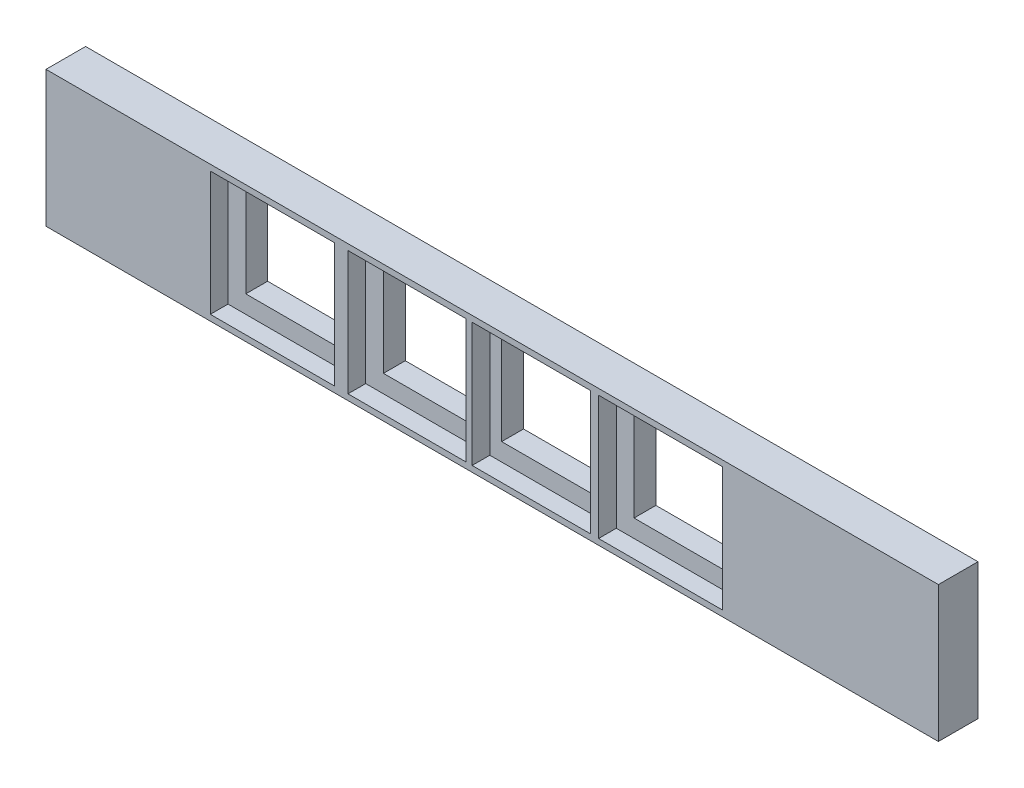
SolidWorks part; units mm, degrees
ref_plane "Front Plane" through (0, 0, 0) normal (0, 0, 1) x (1, 0, 0)
ref_plane "Top Plane" through (0, 0, 0) normal (0, 1, 0) x (1, 0, 0)
ref_plane "Right Plane" through (0, 0, 0) normal (1, 0, 0) x (0, 0, -1)
sketch "Sketch1" plane through (0, 0, 0) normal (0, 0, 1) x (1, 0, 0)
  line L0 (151, 11.5) -> (119, 11.5) construction
  line L1 (0, 0) -> (151, 0)
  line L2 (0, 0) -> (0, 23)
  line L3 (0, 23) -> (151, 23)
  line L4 (151, 0) -> (151, 23)
  line L5 (0, 11.5) -> (19, 11.5) construction
  dimension "D1" = 151
  dimension "D2" = 23
  dimension "D3" = 32
  dimension "D4" = 19
extrude "Boss-Extrude1" add sketch "Sketch1" along normal blind 6.7 contours L2 L3 L4 L1
sketch "Sketch2" plane through (0, 0, 6.7) normal (0, 0, 1) x (1, 0, 0)
  line L0 (151, 11.5) -> (104, 11.5) construction
  line L1 (151, 0) -> (151, 23) construction
  line L2 (111.5, 19) -> (96.5, 4) construction
  line L3 (96.5, 19) -> (111.5, 19)
  line L4 (96.5, 19) -> (96.5, 4)
  line L5 (96.5, 4) -> (111.5, 4)
  line L6 (111.5, 19) -> (111.5, 4)
  line L7 (96.5, 11.5) -> (89.1, 11.5) construction
  line L8 (74.1, 11.5) -> (69.1, 11.5) construction
  line L9 (74.1, 19) -> (89.1, 19)
  line L10 (74.1, 19) -> (74.1, 4)
  line L11 (74.1, 4) -> (89.1, 4)
  line L12 (89.1, 19) -> (89.1, 4)
  line L13 (54.1, 11.5) -> (45.8, 11.5) construction
  line L14 (69.1, 19) -> (54.1, 19)
  line L15 (69.1, 19) -> (69.1, 4)
  line L16 (69.1, 4) -> (54.1, 4)
  line L17 (54.1, 19) -> (54.1, 4)
  line L19 (45.8, 19) -> (30.8, 19)
  line L20 (45.8, 19) -> (45.8, 4)
  line L21 (45.8, 4) -> (30.8, 4)
  line L22 (30.8, 19) -> (30.8, 4)
  point P8 (104, 11.5)
  dimension "D1" = 47
  dimension "D2" = 15
  dimension "D3" = 15
  dimension "D4" = 7.4
  dimension "D5" = 15
  dimension "D6" = 15
  dimension "D7" = 5
  dimension "D8" = 15
  dimension "D9" = 15
  dimension "D10" = 8.3
  dimension "D11" = 15
  dimension "D12" = 15
extrude "Cut-Extrude1" cut sketch "Sketch2" against normal blind 6.7
sketch "Sketch3" plane through (0, 0, 6.7) normal (0, 0, 1) x (1, 0, 0)
  line L0 (45.8, 11.5) -> (48.8, 11.5) construction
  line L1 (45.8, 4) -> (45.8, 19) construction
  line L2 (30.8, 11.5) -> (27.8, 11.5) construction
  line L3 (30.8, 19) -> (30.8, 4) construction
  line L4 (38.3, 19) -> (38.3, 22) construction
  line L5 (45.8, 19) -> (30.8, 19) construction
  line L6 (38.3, 4) -> (38.3, 1) construction
  line L7 (30.8, 4) -> (45.8, 4) construction
  line L8 (69.1, 11.5) -> (71.1, 11.5) construction
  line L9 (27.8, 22) -> (48.8, 22)
  line L10 (27.8, 22) -> (27.8, 1)
  line L11 (27.8, 1) -> (48.8, 1)
  line L12 (48.8, 22) -> (48.8, 1)
  line L13 (69.1, 4) -> (69.1, 19) construction
  line L14 (61.6, 19) -> (61.6, 22) construction
  line L15 (69.1, 19) -> (54.1, 19) construction
  line L16 (54.1, 11.5) -> (51.1, 11.5) construction
  line L17 (54.1, 19) -> (54.1, 4) construction
  line L18 (61.6, 4) -> (61.6, 1) construction
  line L19 (54.1, 4) -> (69.1, 4) construction
  line L20 (89.1, 11.5) -> (92.1, 11.5) construction
  line L21 (89.1, 4) -> (89.1, 19) construction
  line L22 (81.6, 19) -> (81.6, 22) construction
  line L23 (89.1, 19) -> (74.1, 19) construction
  line L24 (81.6, 4) -> (81.6, 1) construction
  line L25 (74.1, 4) -> (89.1, 4) construction
  line L26 (74.1, 11.5) -> (72.1, 11.5) construction
  line L27 (74.1, 19) -> (74.1, 4) construction
  line L28 (111.5, 11.5) -> (114.5, 11.5) construction
  line L29 (111.5, 4) -> (111.5, 19) construction
  line L30 (104, 4) -> (104, 1) construction
  line L31 (96.5, 4) -> (111.5, 4) construction
  line L32 (104, 19) -> (104, 22) construction
  line L33 (111.5, 19) -> (96.5, 19) construction
  line L34 (96.5, 11.5) -> (93.5, 11.5) construction
  line L35 (96.5, 19) -> (96.5, 4) construction
  line L37 (51.1, 22) -> (71.1, 22)
  line L38 (51.1, 22) -> (51.1, 1)
  line L39 (51.1, 1) -> (71.1, 1)
  line L40 (71.1, 22) -> (71.1, 1)
  line L41 (72.1, 22) -> (92.1, 22)
  line L42 (72.1, 22) -> (72.1, 1)
  line L43 (72.1, 1) -> (92.1, 1)
  line L44 (92.1, 22) -> (92.1, 1)
  line L45 (93.5, 22) -> (114.5, 22)
  line L46 (93.5, 22) -> (93.5, 1)
  line L47 (93.5, 1) -> (114.5, 1)
  line L48 (114.5, 22) -> (114.5, 1)
  dimension "D1" = 3
  dimension "D2" = 3
  dimension "D3" = 3
  dimension "D4" = 3
  dimension "D5" = 3
  dimension "D6" = 3
  dimension "D7" = 2
  dimension "D8" = 3
  dimension "D9" = 2
  dimension "D10" = 3
  dimension "D11" = 3
  dimension "D12" = 3
  dimension "D13" = 3
  dimension "D14" = 3
  dimension "D15" = 3
  dimension "D16" = 3
extrude "Cut-Extrude2" cut sketch "Sketch3" against normal blind 3
